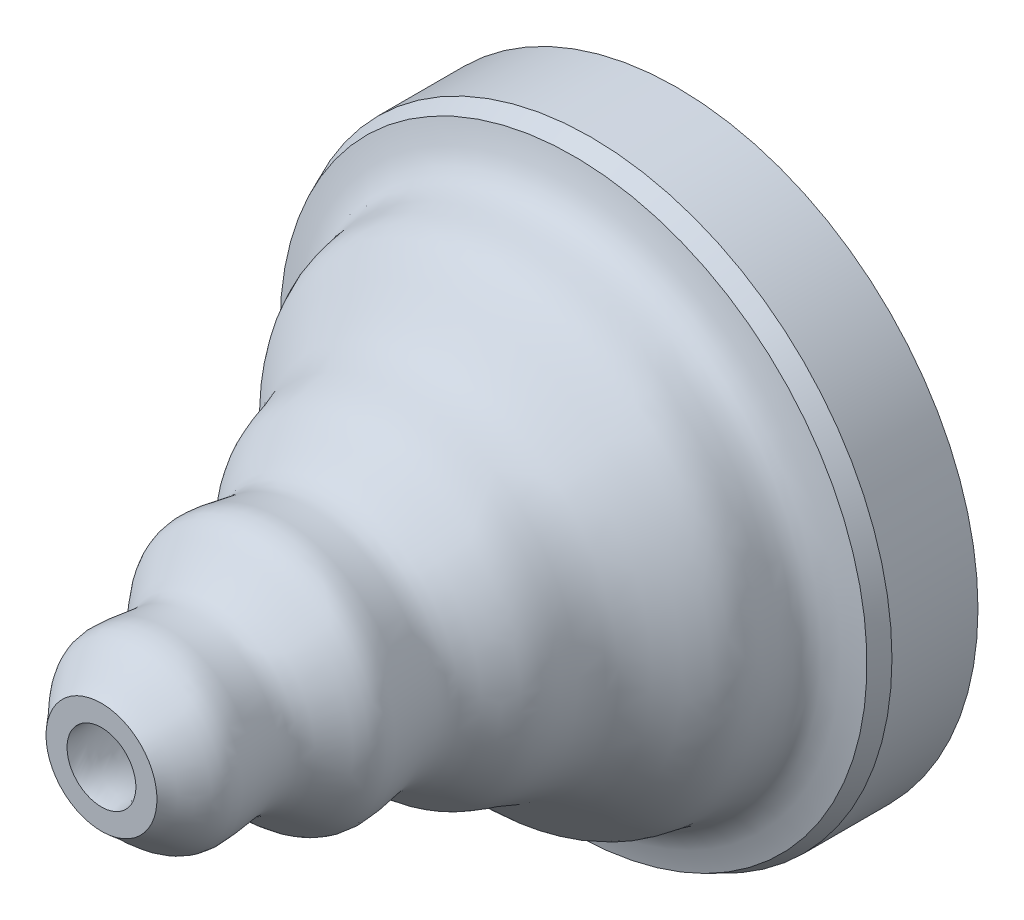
SolidWorks part; units mm, degrees
ref_plane "Plan de face" through (0, 0, 0) normal (0, 0, 1) x (1, 0, 0)
ref_plane "Plan de dessus" through (0, 0, 0) normal (0, 1, 0) x (1, 0, 0)
ref_plane "Plan de droite" through (0, 0, 0) normal (1, 0, 0) x (0, 0, -1)
sketch "Esquisse1" plane through (0, 0, 0) normal (0, 0, 1) x (1, 0, 0)
  circle A0 centre (0, 0) radius 17.5
  circle A1 centre (0, 0) radius 12.5
  dimension "D1" = 35
  dimension "D2" = 25
extrude "Extrusion1" add sketch "Esquisse1" along normal blind 5
ref_plane "Plan1" through (0, 0, 33.45) normal (0, 0, 1) x (1, 0, 0)
sketch "Esquisse2" plane through (0, 0, 33.45) normal (0, 0, 1) x (1, 0, 0)
  circle A1 centre (0, 0) radius 5
  dimension "D2" = 10
sketch "Esquisse3" plane through (0, 0, 5) normal (0, 0, 1) x (1, 0, 0)
  circle A0 centre (0, 0) radius 17.5 construction
  circle A1 centre (0, 0) radius 17.5
loft "Lissage1" add profiles "Esquisse3", "Esquisse2"
sketch "Esquisse5" plane through (0, 0, 5) normal (0, 0, -1) x (-1, 0, 0)
  circle A0 centre (0, 0) radius 15
  dimension "D1" = 30
sketch "Esquisse7" plane through (0, 0, 33.45) normal (0, 0, 1) x (1, 0, 0)
  circle A0 centre (0, 0) radius 2
  dimension "D1" = 4
loft "Enlèvement de matière-Lissage1" cut profiles "Esquisse7", "Esquisse5"
sketch "Esquisse8" plane through (0, 0, 0) normal (0, 1, 0) x (1, 0, 0)
  line L1 (-19.25, -33.45) -> (19.25, -33.45) construction
  line L2 (17.0565, -6.0095) -> (27.0978, -7.5628)
  line L3 (27.0978, -7.5628) -> (20.9641, -33.45)
  line L4 (20.9641, -33.45) -> (3.2237, -33.45)
  spline S0 degree 3 poles (17.0565, -6.0095) (16.0849, -6.2574) (14.0412, -6.7788) (14.2881, -9.8636) (12.3468, -12.0526) (9.8268, -14.0314) (9.5821, -17.8916) (6.0299, -20.3282) (8.3821, -24.6554) (3.8955, -26.9524) (6.0909, -31.0684) (3.6984, -32.7376) (3.2237, -33.45) knots 0 0 0 0 0.032276 0.067891 0.091603 0.136911 0.177984 0.222385 0.26723 0.311587 0.357589 0.394054 0.394054 0.394054 0.394054
revolve "Enlèvement de matière-Révolution1" cut sketch "Esquisse8" angle 360 about axis through (0, 0, 33.45) along (0, 0, -1)
